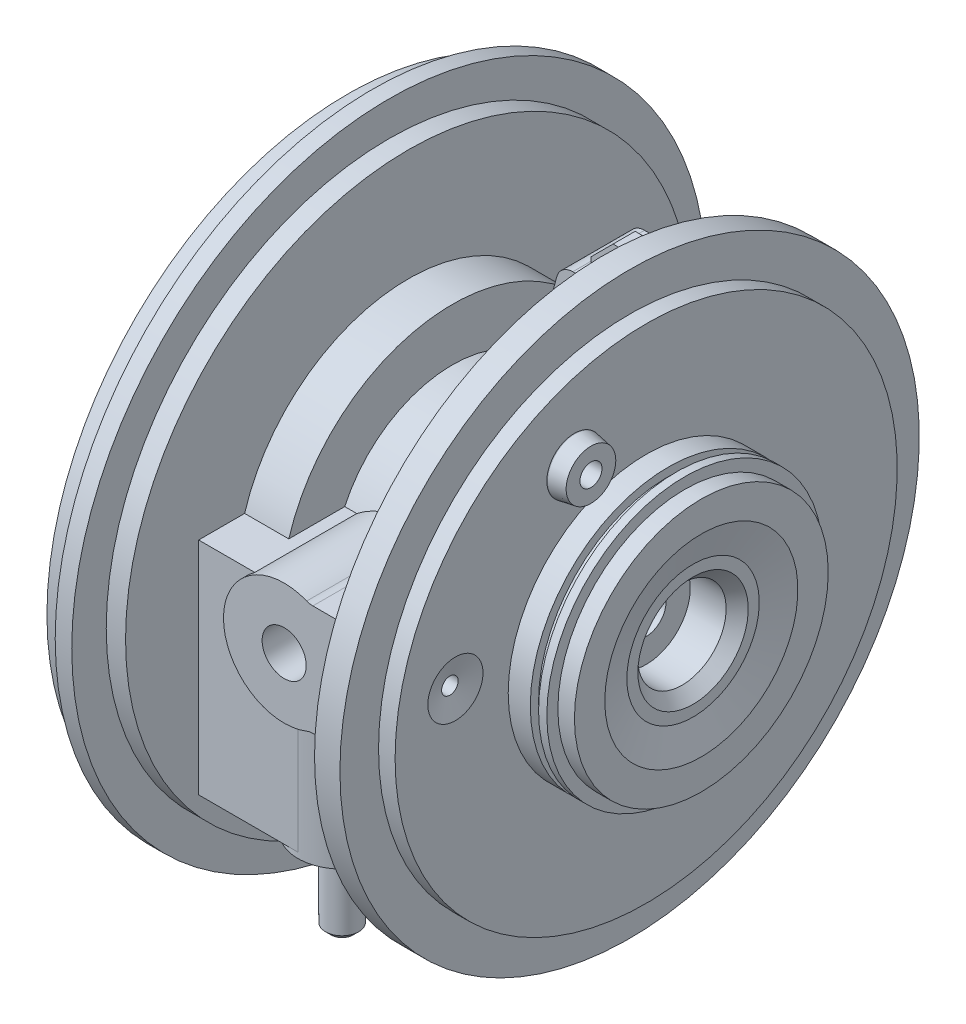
SolidWorks part; units mm, degrees
ref_plane "Plan de face" through (0, 0, 0) normal (0, 0, 1) x (1, 0, 0)
ref_plane "Plan de dessus" through (0, 0, 0) normal (0, 1, 0) x (1, 0, 0)
ref_plane "Plan de droite" through (0, 0, 0) normal (1, 0, 0) x (0, 0, -1)
sketch "Esquisse1" plane through (0, 0, 0) normal (0, 0, 1) x (1, 0, 0)
  line L0 (-54.6, 0) -> (-10, 0)
  line L1 (0, 17.5) -> (0, 23)
  line L2 (0, 23) -> (-3, 23)
  line L3 (-3, 23) -> (-3, 25)
  line L4 (-3, 25) -> (-4.5, 25)
  line L5 (-4.5, 25) -> (-4.5, 23.5)
  line L6 (-4.5, 23.5) -> (-6, 23.5)
  line L7 (-6, 23.5) -> (-6, 25)
  line L8 (-6, 25) -> (-10, 25)
  line L9 (-10, 25) -> (-10, 45.5)
  line L10 (-10, 45.5) -> (-13, 45.5)
  line L11 (-13, 45.5) -> (-13, 52.5)
  line L12 (-13, 52.5) -> (-17.6, 52.5)
  line L13 (-17.6, 52.5) -> (-17.6, 46.5)
  line L14 (-17.6, 46.5) -> (-19.6, 46.5)
  line L15 (-19.6, 46.5) -> (-19.6, 21.5)
  line L16 (-19.6, 21.5) -> (-45.1, 21.5)
  line L17 (-45.1, 21.5) -> (-45.1, 31)
  line L18 (-45.1, 31) -> (-53.1, 31)
  line L19 (-53.1, 31) -> (-53.1, 51.25)
  line L20 (-53.1, 51.25) -> (-56.6, 51.25)
  line L21 (-56.6, 51.25) -> (-56.6, 57.5)
  line L22 (-56.6, 57.5) -> (-59.6, 57.5)
  line L23 (-59.6, 57.5) -> (-59.6, 54.5)
  line L24 (-59.6, 54.5) -> (-64.1, 54.5)
  line L25 (-64.1, 54.5) -> (-64.1, 53.5)
  line L26 (-53.6, 4.5) -> (-54.6, 4.5)
  line L27 (-59.1, 44.8397) -> (-59.1, 24)
  line L28 (-59.1, 24) -> (-58.1, 24)
  line L29 (0, 17.5) -> (-1.5, 12)
  line L30 (-54.6, 4.5) -> (-54.6, 0)
  line L31 (-58.1, 24) -> (-58.1, 21)
  line L32 (-1.5, 12) -> (-1.5, 10)
  line L33 (-1.5, 10) -> (-3.5, 8)
  line L34 (-3.5, 8) -> (-10, 8)
  line L35 (-10, 8) -> (-10, 0)
  arc A0 (-59.1, 44.8397) -> (-64.1, 53.5) centre (-69.1, 44.8397) ccw
  arc A1 (-58.1, 21) -> (-53.6, 4.5) centre (-25.6, 21) ccw
  dimension "D25" = 10
  dimension "D1" = 4.6
  dimension "D2" = 3
  dimension "D3" = 2
  dimension "D4" = 23
  dimension "D5" = 25
  dimension "D6" = 1.5
  dimension "D7" = 1.5
  dimension "D8" = 3
  dimension "D9" = 1.5
  dimension "D10" = 7
  dimension "D11" = 45.5
  dimension "D12" = 21.5
  dimension "D13" = 52.5
  dimension "D14" = 46.5
  dimension "D15" = 3
  dimension "D16" = 4.5
  dimension "D17" = 3.5
  dimension "D18" = 31
  dimension "D19" = 33.5
  dimension "D20" = 8
  dimension "D21" = 51.25
  dimension "D22" = 57.5
  dimension "D23" = 54.5
  dimension "D24" = 5
  dimension "D26" = 1
  dimension "D27" = 1
  dimension "D28" = 24
  dimension "D29" = 9.5
  dimension "D30" = 3
  dimension "D31" = 4.5
  dimension "D32" = 1
  dimension "D33" = 17.5
  dimension "D34" = 12
  dimension "D35" = 8
  dimension "D36" = 10
  dimension "D37" = 45
  dimension "D38" = 2
  dimension "D39" = 1.5
revolve "Révolution1" add sketch "Esquisse1" angle 360 about L0
fillet "Congé2" radius 0.5 2 edges at (-59.1, 0, 24) (-64.1, 0, 53.5)
ref_plane "Plan1" through (0, -31, 0) normal (0, 1, 0) x (-1, 0, 0)
sketch "Esquisse4" plane through (0, -31, 0) normal (0, 1, 0) x (-1, 0, 0)
  line L0 (53.1, 51.25) -> (53.1, -51.25) construction
  line L1 (53.1, 38) -> (35.1, 38)
  line L2 (53.1, 38) -> (53.1, -29)
  line L3 (53.1, -29) -> (35.1, -29)
  line L5 (35.1, 30) -> (35.1, -21) construction
  line L6 (19.6, -46.5) -> (19.6, 46.5) construction
  line L7 (22.6, 27) -> (19.6, 27)
  line L8 (35.1, 4.5) -> (19.6, 4.5) construction
  line L9 (22.6, -18) -> (19.6, -18)
  line L10 (19.6, 27) -> (19.6, -18)
  line L12 (22.6, 27) -> (28.7975, 34.9273)
  line L13 (22.6, -18) -> (28.7975, -25.9273)
  arc A0 (35.1, 38) -> (28.7975, 34.9273) centre (35.1, 30) ccw
  arc A1 (28.7975, -25.9273) -> (35.1, -29) centre (35.1, -21) ccw
  dimension "D4" = 16
  dimension "D5" = 16
  dimension "D1" = 12.5
  dimension "D2" = 38
  dimension "D3" = 18
  dimension "D6" = 12.5
  dimension "D7" = 45
  dimension "D8" = 67
extrude "Extrusion1" add sketch "Esquisse4" along normal blind 40
sketch "Esquisse2" plane through (-54.6, 0, 0) normal (-1, 0, 0) x (0, 0, 1)
  circle A0 centre (0, 0) radius 2.5
  dimension "D1" = 5
extrude "Enlèv. mat.-Extru.1" cut sketch "Esquisse2" against normal through all
sketch "Esquisse3" plane through (0, 0, 0) normal (1, 0, 0) x (0, 0, -1)
  circle A0 centre (0, 0) radius 3.6
  dimension "D1" = 7.2
extrude "Enlèv. mat.-Extru.2" cut sketch "Esquisse3" against normal blind 25
sketch "Esquisse5" plane through (0, -31, 0) normal (0, -1, 0) x (1, 0, 0)
  line L0 (-35.1, -21) -> (-35.1, 30) construction
  line L1 (-46.6631, 24.1325) -> (-42.3505, 33.3809)
  line L3 (-47.6, 19.9063) -> (-47.6, -10.9063)
  line L5 (-22.6, 19.9063) -> (-22.6, -10.9063)
  line L6 (-23.5369, 24.1325) -> (-27.8495, 33.3809)
  line L7 (-46.6631, -15.1325) -> (-42.3505, -24.3809)
  line L8 (-23.5369, -15.1325) -> (-27.8495, -24.3809)
  arc A0 (-28.7975, 34.9273) -> (-35.1, 38) centre (-35.1, 30) ccw construction
  arc A1 (-27.8495, 33.3809) -> (-42.3505, 33.3809) centre (-35.1, 30) ccw
  arc A2 (-42.3505, -24.3809) -> (-27.8495, -24.3809) centre (-35.1, -21) ccw
  arc A3 (-47.6, 19.9063) -> (-46.6631, 24.1325) centre (-37.6, 19.9063) cw
  arc A4 (-46.6631, -15.1325) -> (-47.6, -10.9063) centre (-37.6, -10.9063) cw
  arc A5 (-22.6, -10.9063) -> (-23.5369, -15.1325) centre (-32.6, -10.9063) cw
  arc A6 (-23.5369, 24.1325) -> (-22.6, 19.9063) centre (-32.6, 19.9063) cw
  dimension "D7" = 10
  dimension "D1" = 25
  dimension "D2" = 12.5
  dimension "D3" = 25
  dimension "D4" = 25
  dimension "D5" = 25
  dimension "D6" = 25
extrude "Extrusion2" add sketch "Esquisse5" along normal blind 1
ref_plane "Plan2" through (0, 0, -31) normal (0, 0, 1) x (1, 0, 0)
sketch "Esquisse6" plane through (0, 0, -31) normal (0, 0, 1) x (1, 0, 0)
  line L0 (-19.6, -17) -> (-19.6, 17)
  line L1 (-19.6, 46.5) -> (-19.6, -46.5) construction
  line L2 (-19.6, 21.5) -> (-19.6, -11.758) construction
  line L3 (-19.6, 17) -> (-21.0826, 17)
  line L4 (-23.9804, 19.2235) -> (-26.0042, 26.7765)
  line L5 (-28.902, 29) -> (-41.298, 29)
  line L6 (-44.1958, 26.7765) -> (-48.0952, 12.2235)
  line L7 (-50.993, 10) -> (-53.1, 10)
  line L8 (-53.1, -10.9545) -> (-53.1, 31) construction
  line L9 (-53.1, 10) -> (-53.1, -10)
  line L10 (-53.1, -51.25) -> (-53.1, 51.25) construction
  line L11 (-35.1, 29) -> (-35.1, 0) construction
  line L12 (-19.6, 0) -> (-53.1, 0) construction
  line L13 (-19.6, -17) -> (-21.0826, -17)
  line L14 (-50.993, -10) -> (-53.1, -10)
  line L15 (-44.1958, -26.7765) -> (-48.0952, -12.2235)
  line L16 (-28.902, -29) -> (-41.298, -29)
  line L17 (-23.9804, -19.2235) -> (-26.0042, -26.7765)
  arc A0 (-21.0826, 17) -> (-23.9804, 19.2235) centre (-21.0826, 20) cw
  arc A1 (-26.0042, 26.7765) -> (-28.902, 29) centre (-28.902, 26) ccw
  arc A2 (-41.298, 29) -> (-44.1958, 26.7765) centre (-41.298, 26) ccw
  arc A3 (-48.0952, 12.2235) -> (-50.993, 10) centre (-50.993, 13) cw
  arc A4 (-48.0952, -12.2235) -> (-50.993, -10) centre (-50.993, -13) ccw
  arc A5 (-41.298, -29) -> (-44.1958, -26.7765) centre (-41.298, -26) cw
  arc A6 (-26.0042, -26.7765) -> (-28.902, -29) centre (-28.902, -26) cw
  arc A7 (-21.0826, -17) -> (-23.9804, -19.2235) centre (-21.0826, -20) ccw
  point P22 (-26.6, 29)
  point P25 (-43.6, 29)
  dimension "D8" = 3
  dimension "D1" = 17
  dimension "D2" = 29
  dimension "D3" = 10
  dimension "D4" = 15.5
  dimension "D5" = 17
  dimension "D6" = 15
  dimension "D7" = 15
extrude "Extrusion3" add sketch "Esquisse6" along normal blind 13
ref_plane "Plan3" through (0, 0, 39) normal (0, 0, -1) x (-1, 0, 0)
sketch "Esquisse7" plane through (0, 0, 39) normal (0, 0, -1) x (-1, 0, 0)
  line L0 (17.6, -52.5) -> (17.6, 52.5) construction
  line L1 (19.6, 9) -> (19.6, 21.5) construction
  line L2 (19.6, 10) -> (31.4038, 10)
  line L3 (19.6, 10) -> (19.6, -10)
  line L4 (19.6, -10) -> (31.4038, -10)
  arc A0 (32.5173, -10.2143) -> (32.5173, 10.2143) centre (36.6, 0) ccw
  arc A1 (31.4038, 10) -> (32.5173, 10.2143) centre (31.4038, 13) ccw
  arc A2 (31.4038, -10) -> (32.5173, -10.2143) centre (31.4038, -13) cw
  dimension "D1" = 22
  dimension "D5" = 3
  dimension "D2" = 19
  dimension "D3" = 20
  dimension "D4" = 10
extrude "Extrusion4" add sketch "Esquisse7" along normal up to next
sketch "Esquisse8" plane through (0, 0, -31) normal (0, 0, -1) x (-1, 0, 0)
  line L0 (35.1, 29) -> (35.1, -29) construction
  line L1 (28.902, 29) -> (41.298, 29) construction
  line L2 (41.298, -29) -> (28.902, -29) construction
  circle A0 centre (35.1, 0) radius 6.5
  circle A1 centre (35.1, 20) radius 2.5
  circle A2 centre (35.1, -20) radius 2.5
  dimension "D1" = 13
  dimension "D4" = 5
  dimension "D5" = 5
  dimension "D2" = 20
  dimension "D3" = 20
extrude "Enlèv. mat.-Extru.3" cut sketch "Esquisse8" against normal blind 12
sketch "Esquisse9" plane through (0, -32, 0) normal (0, -1, 0) x (1, 0, 0)
  line L0 (-35.1, 30) -> (-35.1, -21) construction
  line L1 (-22.6, 4.5) -> (-47.6, 4.5) construction
  line L2 (-22.6, -10.9063) -> (-22.6, 19.9063) construction
  line L3 (-47.6, 19.9063) -> (-47.6, -10.9063) construction
  circle A0 centre (-35.1, 16.5) radius 4
  circle A1 centre (-35.1, -7.5) radius 4
  dimension "D1" = 8
  dimension "D2" = 8
  dimension "D3" = 12
  dimension "D4" = 12
extrude "Enlèv. mat.-Extru.4" cut sketch "Esquisse9" against normal blind 12
sketch "Esquisse10" plane through (0, -32, 0) normal (0, -1, 0) x (1, 0, 0)
  circle A0 centre (-35.1, 30) radius 3
  circle A1 centre (-35.1, -21) radius 3
  dimension "D1" = 6
  dimension "D2" = 6
extrude "Extrusion5" add sketch "Esquisse10" along normal blind 15
chamfer "Chanfrein1" distance 1 angle 45 2 edges at (-35.1, -47, -24) (-35.1, -47, 27)
sketch "Esquisse11" plane through (0, 0, 39) normal (0, 0, 1) x (1, 0, 0)
  circle A0 centre (-36.6, 0) radius 4
  dimension "D1" = 8
extrude "Enlèv. mat.-Extru.5" cut sketch "Esquisse11" against normal blind 34
sketch "Esquisse12" plane through (-19.6, 0, 0) normal (-1, 0, 0) x (0, 0, 1)
  line L1 (-31, -17) -> (-31, 17) construction
  circle A0 centre (13, 29.7867) radius 5
  dimension "D1" = 10
  dimension "D2" = 32.5
  dimension "D3" = 44
extrude "Extrusion6" add sketch "Esquisse12" along normal blind 4
sketch "Esquisse14" plane through (-10, 0, 0) normal (1, 0, 0) x (0, 0, -1)
  circle A0 centre (-13, 29.7867) radius 5
  dimension "D1" = 10
extrude "Extrusion7" add sketch "Esquisse14" along normal blind 3
chamfer "Chanfrein2" distance 2.9 distance2 0.5 1 edges at (-7, 29.7867, 8)
sketch "Esquisse13" plane through (-23.6, 0, 0) normal (-1, 0, 0) x (0, 0, 1)
  circle A0 centre (13, 29.7867) radius 2
  dimension "D1" = 4
extrude "Enlèv. mat.-Extru.6" cut sketch "Esquisse13" against normal through all
ref_plane "Plan4" through (0, 0, -19) normal (0, 0, -1) x (-1, 0, 0)
sketch "Esquisse15" plane through (0, 0, -19) normal (0, 0, -1) x (-1, 0, 0)
  line L0 (19.6, 44) -> (27, 44)
  line L1 (19.6, -46.5) -> (19.6, 46.5) construction
  line L2 (27, 44) -> (31, 40)
  line L3 (31, 40) -> (31, 9)
  line L4 (31, 9) -> (19.6, 9)
  line L5 (19.6, -17) -> (19.6, 17) construction
  line L6 (19.6, 9) -> (19.6, 44)
  line L7 (13, 52.5) -> (13, -52.5) construction
  dimension "D1" = 44
  dimension "D2" = 18
  dimension "D3" = 35
  dimension "D4" = 45
  dimension "D5" = 4
extrude "Extrusion8" add sketch "Esquisse15" against normal blind 8
sketch "Esquisse16" plane through (0, 0, -19) normal (0, 0, -1) x (-1, 0, 0)
  line L0 (27, 44) -> (19.6, 44) construction
  line L2 (18.1, 54.5) -> (38.1, 54.5)
  line L3 (18.1, 54.5) -> (18.1, 33.5)
  line L4 (22.1, 29.5) -> (38.1, 29.5)
  line L5 (38.1, 54.5) -> (38.1, 29.5)
  line L6 (17.6, -52.5) -> (17.6, 52.5) construction
  arc A0 (22.1, 29.5) -> (18.1, 33.5) centre (22.1, 33.5) cw
  dimension "D5" = 4
  dimension "D1" = 14.5
  dimension "D2" = 0.5
  dimension "D3" = 20
  dimension "D4" = 25
extrude "Enlèv. mat.-Extru.7" cut sketch "Esquisse16" against normal blind 4 and the other way blind 20
sketch "Esquisse17" plane through (0, 0, -15) normal (0, 0, -1) x (-1, 0, 0)
  line L0 (31, 29.5) -> (22.1, 29.5) construction
  line L1 (13, 52.5) -> (13, -52.5) construction
  circle A0 centre (25, 38) radius 2
  dimension "D1" = 4
  dimension "D2" = 8.5
  dimension "D3" = 12
extrude "Enlèv. mat.-Extru.8" cut sketch "Esquisse17" against normal up to next
sketch "Esquisse18" plane through (-10, 0, 0) normal (1, 0, 0) x (0, 0, -1)
  circle A0 centre (-34.569, 5.4757) radius 1.5
  circle A2 centre (-13, 29.7867) radius 5 construction
  dimension "D1" = 3
  dimension "D3" = 32.5
  dimension "D2" = 35
extrude "Enlèv. mat.-Extru.9" cut sketch "Esquisse18" against normal blind 9
chamfer "Chanfrein3" distance 3.5 distance2 1 1 edges at (-10, 5.4757, 33.069)
